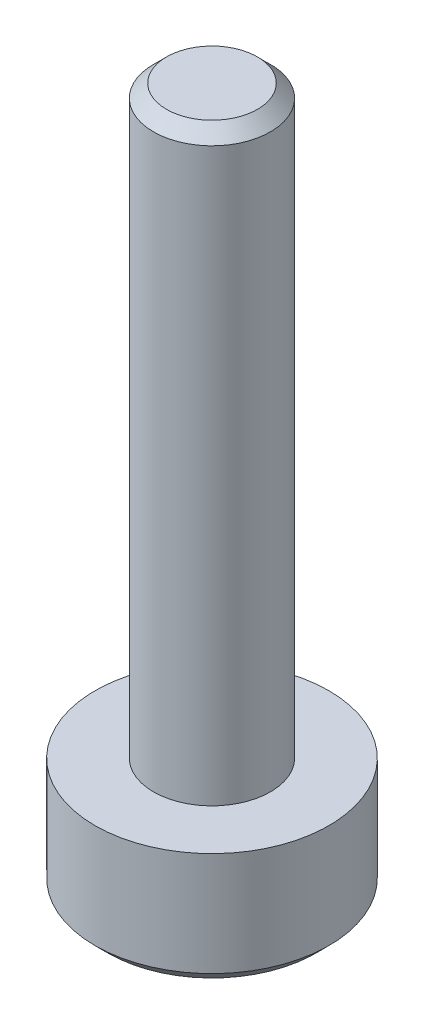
SolidWorks part; units mm, degrees
ref_plane "Front Plane" through (0, 0, 0) normal (0, 0, 1) x (1, 0, 0)
ref_plane "Top Plane" through (0, 0, 0) normal (0, 1, 0) x (1, 0, 0)
ref_plane "Right Plane" through (0, 0, 0) normal (1, 0, 0) x (0, 0, -1)
sketch "Sketch1" plane through (0, 0, 0) normal (0, 1, 0) x (1, 0, 0)
  circle A0 centre (0, 0) radius 1.5
  dimension "D1" = 3
extrude "Boss-Extrude1" add sketch "Sketch1" along normal blind 15
sketch "Sketch2" plane through (0, 0, 0) normal (0, -1, 0) x (1, 0, 0)
  circle A0 centre (0, 0) radius 3
  circle A1 centre (0, 0) radius 1.5 construction
extrude "Boss-Extrude2" add sketch "Sketch2" along normal blind 3 contours A0
sketch "Sketch3" plane through (0, -3, 0) normal (0, -1, 0) x (1, 0, 0)
  line L1 (0, 1.7321) -> (-1.5, 0.866)
  line L2 (-1.5, 0.866) -> (-1.5, -0.866)
  line L3 (-1.5, -0.866) -> (0, -1.7321)
  line L4 (0, -1.7321) -> (1.5, -0.866)
  line L5 (1.5, -0.866) -> (1.5, 0.866)
  line L6 (1.5, 0.866) -> (0, 1.7321)
  circle A0 centre (0, 0) radius 1.5 construction
extrude "Cut-Extrude1" cut sketch "Sketch3" against normal blind 2
chamfer "Chamfer1" distance 0.3333 angle 45 2 edges at (0, 15, 1.5) (0, -3, -3)
equation "\"Length\"= 15"
equation "\"Dia\"= 3"
equation "\"D1@Sketch2\"=\"Dia\"/2"
equation "\"D1@Boss-Extrude2\"=\"Dia\""
equation "\"D1@Sketch3\"=\"Dia\""
equation "\"D1@Cut-Extrude1\"=\"Dia\"/1.5"
equation "\"D1@Chamfer1\"=\"Dia\"/(\"Dia\"*3)"
equation "\"D1@Boss-Extrude1\"=\"Length\""
